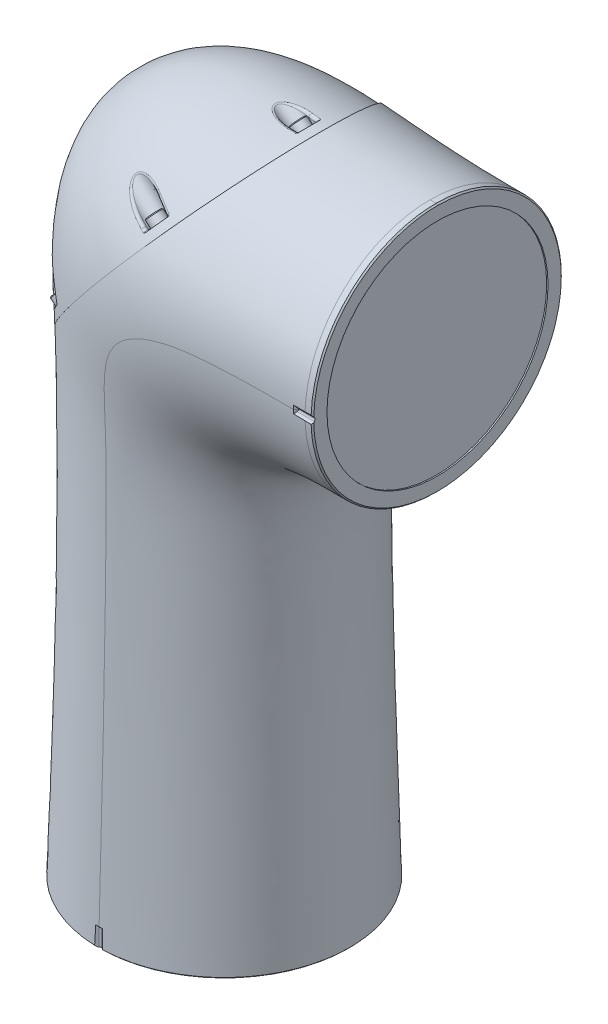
SolidWorks part; units mm, degrees
other "NONE"
ref_plane "前视基准面" through (0, 0, 0) normal (0, 0, 1) x (1, 0, 0)
ref_plane "上视基准面" through (0, 0, 0) normal (0, 1, 0) x (1, 0, 0)
ref_plane "右视基准面" through (0, 0, 0) normal (1, 0, 0) x (0, 0, -1)
imported_body "输入1"
sketch "草图1" plane through (0, 888, 0) normal (0, -1, 0) x (1, 0, 0)
  circle A0 centre (33.818, 0) radius 40.1576
extrude "切除-拉伸1" cut sketch "草图1" against normal blind 0.5
sketch "草图2" plane through (112.3, 0, 0) normal (1, 0, 0) x (0, 0, -1)
  circle A0 centre (0, 1095.4999) radius 40.6597
extrude "切除-拉伸2" cut sketch "草图2" against normal blind 0.5
